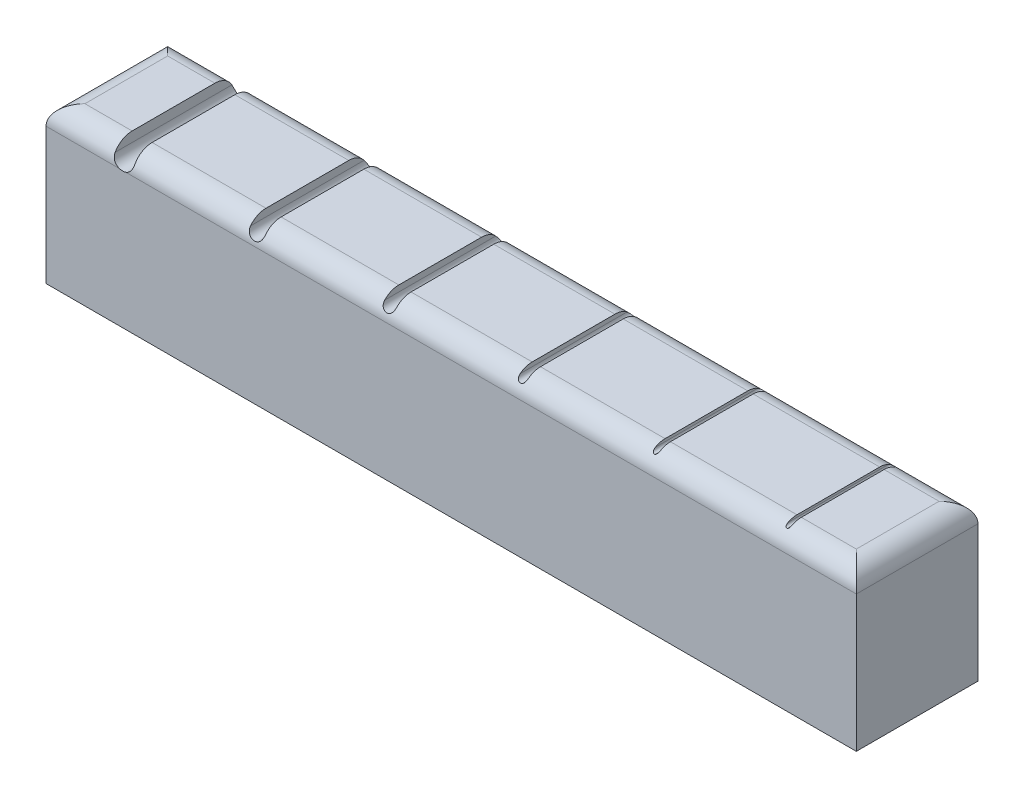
SolidWorks part; units mm, degrees
ref_plane "Front" through (0, 0, 0) normal (0, 0, 1) x (1, 0, 0)
ref_plane "Top" through (0, 0, 0) normal (0, 1, 0) x (1, 0, 0)
ref_plane "Right" through (0, 0, 0) normal (1, 0, 0) x (0, 0, -1)
sketch "Sketch2" plane through (0, 0, 0) normal (0, 0, 1) x (1, 0, 0)
  line L0 (-21.1455, 0) -> (21.1455, 0)
  line L1 (-21.1455, 0) -> (-21.1455, 8.128)
  line L2 (-21.1455, 8.128) -> (21.1455, 8.128)
  line L3 (21.1455, 8.128) -> (21.1455, 0)
  arc A0 (-21.1455, 8.128) -> (21.1455, 8.128) centre (0, -244.9903) cw construction
  dimension "D2" = 254
  dimension "D1" = 42.291
  dimension "D3" = 8.128
extrude "Boss-Extrude1" add sketch "Sketch2" along normal mid plane 6.35
fillet "Fillet1" radius 1.016 4 edges at (21.1455, 8.128, 0) (0, 8.128, -3.175) (-21.1455, 8.128, 0) (0, 8.128, 3.175)
sketch "Sketch4" plane through (0, 0, 0) normal (0, 0, 1) x (1, 0, 0)
  line L0 (-17.6657, 8.128) -> (-16.6243, 8.128)
  line L1 (0, 2.413) -> (0, 8.603) construction
  line L2 (-10.6807, 8.128) -> (-9.8933, 8.128)
  line L3 (-20.1295, 8.128) -> (20.1295, 8.128) construction
  line L5 (-17.6657, 7.6073) -> (-17.6657, 8.128)
  line L6 (-16.6243, 7.6073) -> (-16.6243, 8.128)
  line L7 (-10.6807, 7.7343) -> (-10.6807, 8.128)
  line L8 (-9.8933, 7.7343) -> (-9.8933, 8.128)
  line L9 (-3.7465, 7.8105) -> (-3.7465, 8.128)
  line L10 (-3.1115, 7.8105) -> (-3.1115, 8.128)
  line L11 (3.2131, 7.9121) -> (3.2131, 8.128)
  line L12 (3.6449, 7.9121) -> (3.6449, 8.128)
  line L13 (10.1473, 7.9883) -> (10.1473, 8.128)
  line L14 (10.4267, 7.9883) -> (10.4267, 8.128)
  line L15 (17.0307, 8.0137) -> (17.0307, 8.128)
  line L16 (17.2593, 8.0137) -> (17.2593, 8.128)
  line L17 (-3.7465, 8.128) -> (-3.1115, 8.128)
  line L18 (3.2131, 8.128) -> (3.6449, 8.128)
  line L19 (10.1473, 8.128) -> (10.4267, 8.128)
  line L20 (17.0307, 8.128) -> (17.2593, 8.128)
  arc A0 (-17.6657, 7.6073) -> (-16.6243, 7.6073) centre (-17.145, 7.6073) ccw
  arc A1 (-10.6807, 7.7343) -> (-9.8933, 7.7343) centre (-10.287, 7.7343) ccw
  arc A2 (-3.7465, 7.8105) -> (-3.1115, 7.8105) centre (-3.429, 7.8105) ccw
  arc A3 (3.2131, 7.9121) -> (3.6449, 7.9121) centre (3.429, 7.9121) ccw
  arc A4 (10.1473, 7.9883) -> (10.4267, 7.9883) centre (10.287, 7.9883) ccw
  arc A5 (17.0307, 8.0137) -> (17.2593, 8.0137) centre (17.145, 8.0137) ccw
  dimension "D1" = 1.0414
  dimension "D4" = 0.7874
  dimension "D5" = 3.429
  dimension "D6" = 0.635
  dimension "D7" = 3.429
  dimension "D8" = 0.4318
  dimension "D9" = 10.287
  dimension "D10" = 0.2794
  dimension "D11" = 17.145
  dimension "D12" = 0.2286
extrude "Cut-Extrude1" cut sketch "Sketch4" against normal through all and the other way through all
